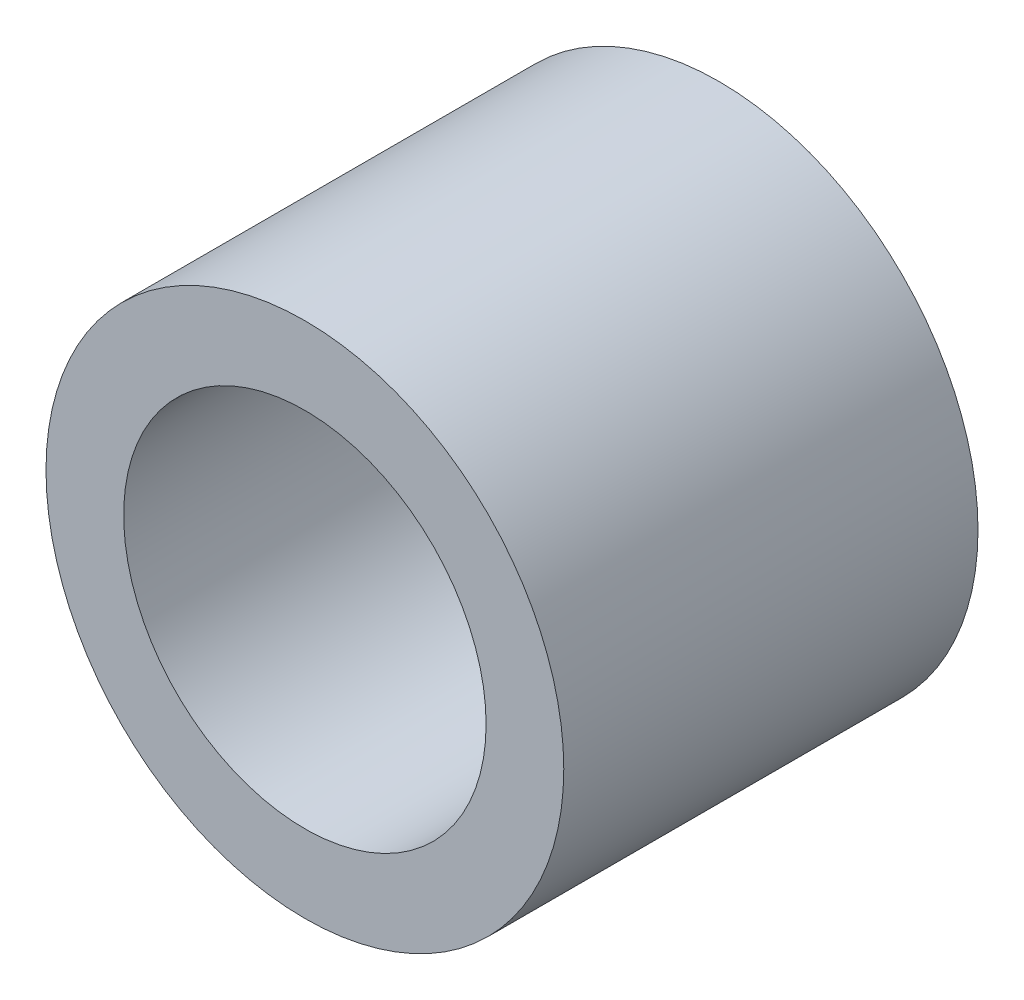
SolidWorks part; units mm, degrees
ref_plane "Front" through (0, 0, 0) normal (0, 0, 1) x (1, 0, 0)
ref_plane "Top" through (0, 0, 0) normal (0, 1, 0) x (1, 0, 0)
ref_plane "Right" through (0, 0, 0) normal (1, 0, 0) x (0, 0, -1)
sketch "Sketch1" plane through (0, 0, 0) normal (0, 0, 1) x (1, 0, 0)
  line L1 (0, 0) -> (4.8093, 0) construction
  line L3 (-4.9024, -1.75) -> (5.4609, -1.75) construction
  circle A0 centre (0, 0) radius 2.5
  circle A1 centre (0, 0) radius 1.75
  dimension "D3" = 3.5
  dimension "D1" = 5
extrude "Base-Extrude" add sketch "Sketch1" along normal blind 4
